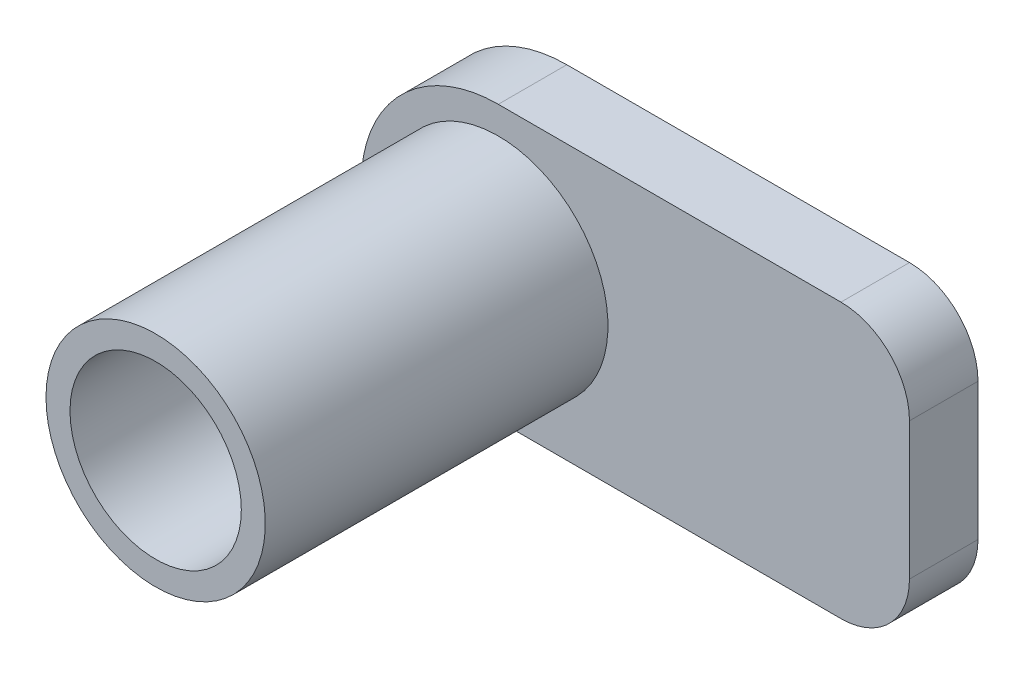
SolidWorks part; units mm, degrees
ref_plane "Front Plane" through (0, 0, 0) normal (0, 0, 1) x (1, 0, 0)
ref_plane "Top Plane" through (0, 0, 0) normal (0, 1, 0) x (1, 0, 0)
ref_plane "Right Plane" through (0, 0, 0) normal (1, 0, 0) x (0, 0, -1)
sketch "Sketch1" plane through (0, 0, 0) normal (0, 0, 1) x (1, 0, 0)
  line L0 (-1778, -778.5652) -> (-1778, -270.5652)
  line L1 (-3302, -1032.5652) -> (-2032, -1032.5652)
  line L2 (-3302, -16.5652) -> (-2032, -16.5652)
  arc A0 (-3302, -1032.5652) -> (-3302, -16.5652) centre (-3302, -524.5652) cw
  arc A1 (-1778, -270.5652) -> (-2032, -16.5652) centre (-2032, -270.5652) ccw
  arc A2 (-2032, -1032.5652) -> (-1778, -778.5652) centre (-2032, -778.5652) ccw
  dimension "D1" = 254
  dimension "D2" = 254
extrude "Boss-Extrude1" add sketch "Sketch1" along normal blind 254
sketch "Sketch2" plane through (0, 0, 254) normal (0, 0, 1) x (1, 0, 0)
  circle A0 centre (-3302, -524.5652) radius 406.4
  dimension "D1" = 812.8
extrude "Boss-Extrude2" add sketch "Sketch2" along normal blind 1270
sketch "Sketch3" plane through (0, 0, 1524) normal (0, 0, 1) x (1, 0, 0)
  circle A0 centre (-3302, -524.5652) radius 317.5
  dimension "D1" = 635
extrude "Cut-Extrude1" cut sketch "Sketch3" against normal blind 762
